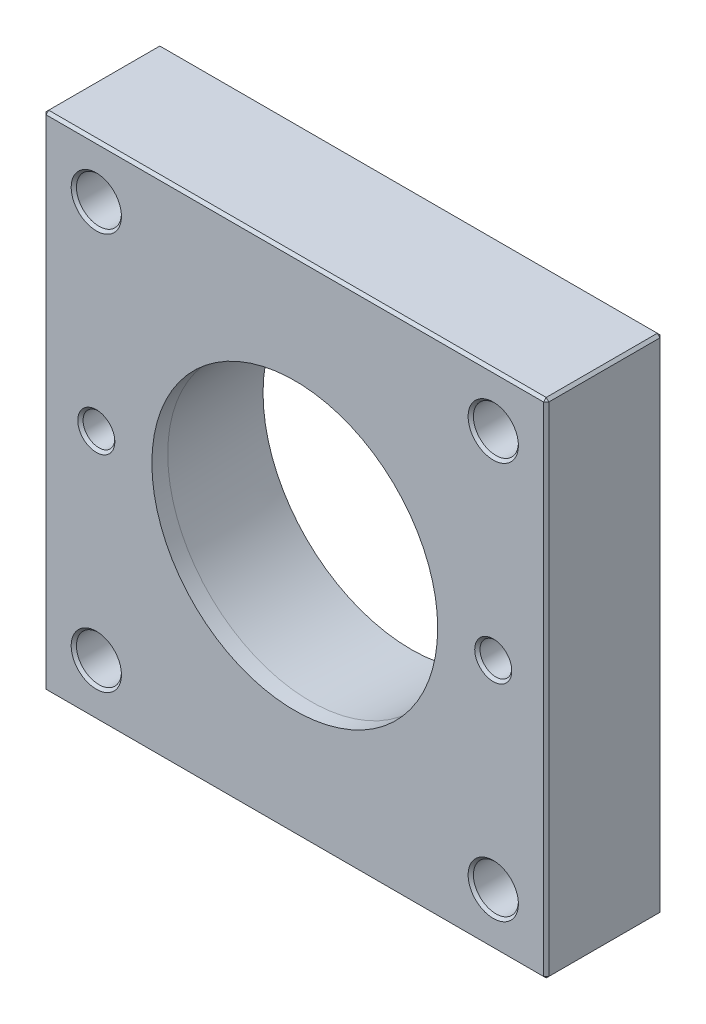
SolidWorks part; units mm, degrees
ref_plane "XY" through (0, 0, 0) normal (0, 0, 1) x (1, 0, 0)
ref_plane "XZ" through (0, 0, 0) normal (0, 1, 0) x (1, 0, 0)
ref_plane "YZ" through (0, 0, 0) normal (1, 0, 0) x (0, 0, -1)
sketch "Esquisse1" plane through (0, 0, 0) normal (0, 0, 1) x (1, 0, 0)
  line L0 (-47.5, -47.5) -> (47.5, -47.5)
  line L1 (-47.5, -47.5) -> (-47.5, 47.5)
  line L2 (47.5, 47.5) -> (-47.5, 47.5)
  line L3 (47.5, 47.5) -> (47.5, -47.5)
  line L4 (0, 54.6582) -> (0, -59.7824) construction
  line L5 (-56.1955, 0) -> (58.9284, 0) construction
  circle A0 centre (0, 0) radius 27
  circle A1 centre (-37.5, -37.5) radius 4.25
  circle A2 centre (-37.5, 37.5) radius 4.25
  circle A3 centre (37.5, -37.5) radius 4.25
  circle A4 centre (37.5, 37.5) radius 4.25
  circle A5 centre (-37.5, 0) radius 3
  circle A6 centre (37.5, 0) radius 3
  dimension "D1" = 54
  dimension "D8" = 8.5
  dimension "D9" = 6
  dimension "D2" = 95
  dimension "D3" = 95
  dimension "D4" = 47.5
  dimension "D5" = 47.5
  dimension "D6" = 37.5
  dimension "D7" = 37.5
extrude "Base-Extrusion" add sketch "Esquisse1" against normal blind 22
ref_plane "Plan4" through (0, 0, -3) normal (0, 0, 1) x (1, 0, 0)
sketch "Esquisse2" plane through (0, 0, -3) normal (0, 0, 1) x (1, 0, 0)
  circle A0 centre (0, 0) radius 27 construction
  circle A1 centre (0, 0) radius 27
extrude "Enlèv. mat.-Extru.3" cut sketch "Esquisse2" against normal up to next (19 mm away) draft 3
chamfer "Chanfrein1" distance 0.5 angle 45 6 edges at (-33.25, -37.5, 0) (-41.75, 37.5, 0) (33.25, -37.5, 0) (41.75, 37.5, 0) (-34.5, 0, 0) (34.5, 0, 0)
chamfer "Chanfrein2" distance 0.5 angle 45 6 edges at (-33.25, -37.5, -22) (-41.75, 37.5, -22) (33.25, -37.5, -22) (41.75, 37.5, -22) (-34.5, 0, -22) (34.5, 0, -22)
chamfer "Chanfrein3" distance 0.5 angle 45 12 edges at (47.5, 0, -22) (0, -47.5, -22) (-47.5, 0, -22) (0, -47.5, 0) (47.5, 0, 0) (0, 47.5, 0) (-47.5, 0, 0) (0, 47.5, -22) (-47.5, -47.5, -11) (47.5, -47.5, -11) (47.5, 47.5, -11) (-47.5, 47.5, -11)
